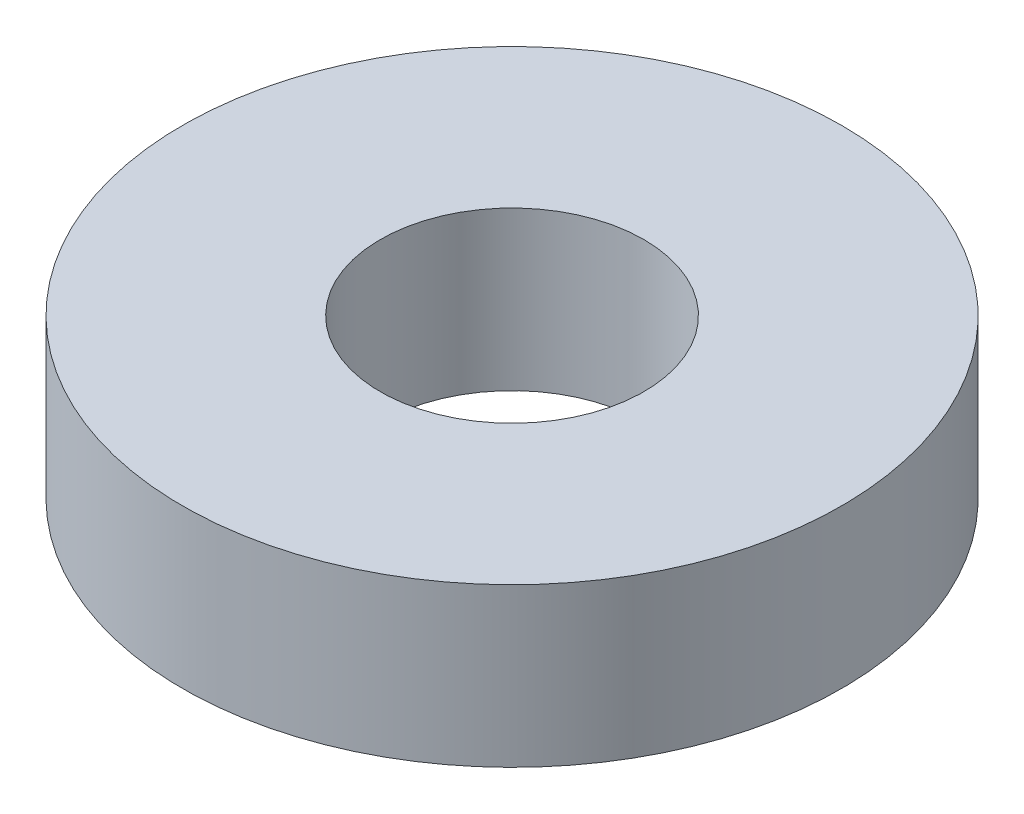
SolidWorks part; units mm, degrees
ref_plane "Front Plane" through (0, 0, 0) normal (0, 0, 1) x (1, 0, 0)
ref_plane "Top Plane" through (0, 0, 0) normal (0, 1, 0) x (1, 0, 0)
ref_plane "Right Plane" through (0, 0, 0) normal (1, 0, 0) x (0, 0, -1)
sketch "Sketch1" plane through (0, 0, 0) normal (0, 1, 0) x (1, 0, 0)
  circle A0 centre (0, 0) radius 7.9375
  circle A1 centre (0, 0) radius 3.175
  dimension "D1" = 6.35
  dimension "D2" = 15.875
extrude "Boss-Extrude1" add sketch "Sketch1" along normal mid plane 3.81
